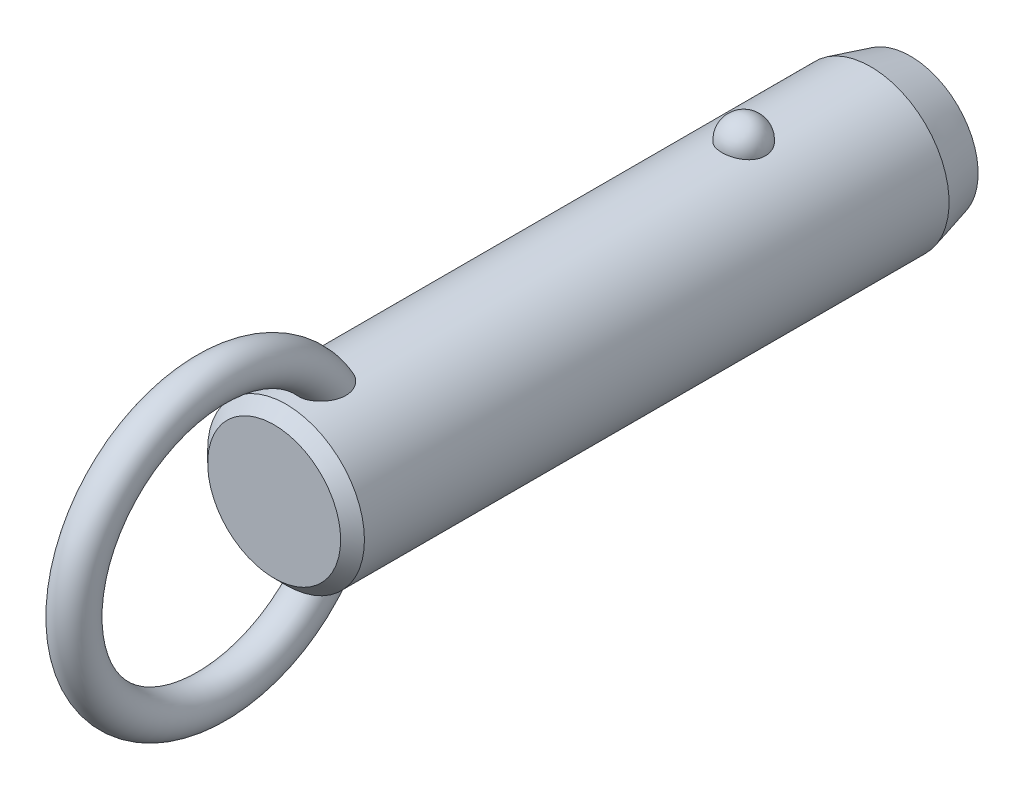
SolidWorks part; units mm, degrees
ref_plane "Front Plane" through (0, 0, 0) normal (0, 0, 1) x (1, 0, 0)
ref_plane "Top Plane" through (0, 0, 0) normal (0, 1, 0) x (1, 0, 0)
ref_plane "Right Plane" through (0, 0, 0) normal (1, 0, 0) x (0, 0, -1)
sketch "Sketch2" plane through (0, 0, 0) normal (0, 0, 1) x (1, 0, 0)
  circle A0 centre (0, 0) radius 7.9
  point P3 (0, 7.9)
  dimension "D1" = 15.8
extrude "Boss-Extrude1" add sketch "Sketch2" along normal blind 35.6
sketch "Sketch3" plane through (0, 0, 0) normal (0, 0, -1) x (-1, 0, 0)
  circle A0 centre (0, 0) radius 7.9
  dimension "D1" = 15.8
extrude "Boss-Extrude2" add sketch "Sketch3" along normal blind 19
chamfer "Chamfer1" distance 4 angle 15 1 edges at (-7.9, 0, -19)
sketch "Sketch12" plane through (0, 0, 0) normal (1, 0, 0) x (0, 0, -1)
  line L0 (-35.6, 7.9) -> (-35.6, -7.9) construction
  point P0 (-35.6, 0)
sketch "Sketch13" plane through (0, 0, 0) normal (1, 0, 0) x (0, 0, -1)
  circle A0 centre (-51.45, 0) radius 15.85
  point P2 (-35.6, 0)
  dimension "D1" = 31.7
sketch "Sketch14" plane through (0, 0, 0) normal (0, 1, 0) x (1, 0, 0)
  circle A0 centre (0, -37.6) radius 2
  point P2 (0, -35.6)
  dimension "D1" = 4
sweep "Sweep1" add profiles "Sketch14" path "Sketch13"
sketch "Sketch15" plane through (0, 0, 35.6) normal (0, 0, 1) x (1, 0, 0)
  circle A0 centre (0, 0) radius 7.9
  dimension "D1" = 15.8
extrude "Boss-Extrude3" add sketch "Sketch15" along normal blind 9.52
chamfer "Chamfer2" distance 1.2 angle 45 1 edges at (7.9, 0, 45.12)
sketch "Sketch18" plane through (0, 0, 0) normal (1, 0, 0) x (0, 0, -1)
  line L0 (15, 7.9) -> (-37.7091, 7.9) construction
  line L1 (2.2, 10.1) -> (2.2, 5.7)
  line L2 (-37.7091, -7.9) -> (15, -7.9) construction
  arc A0 (2.2, 10.1) -> (2.2, 5.7) centre (2.2, 7.9) ccw
  point P4 (0, 7.9)
  dimension "D1" = 18
revolve "Revolve1" add sketch "Sketch18" angle 360 about L1
